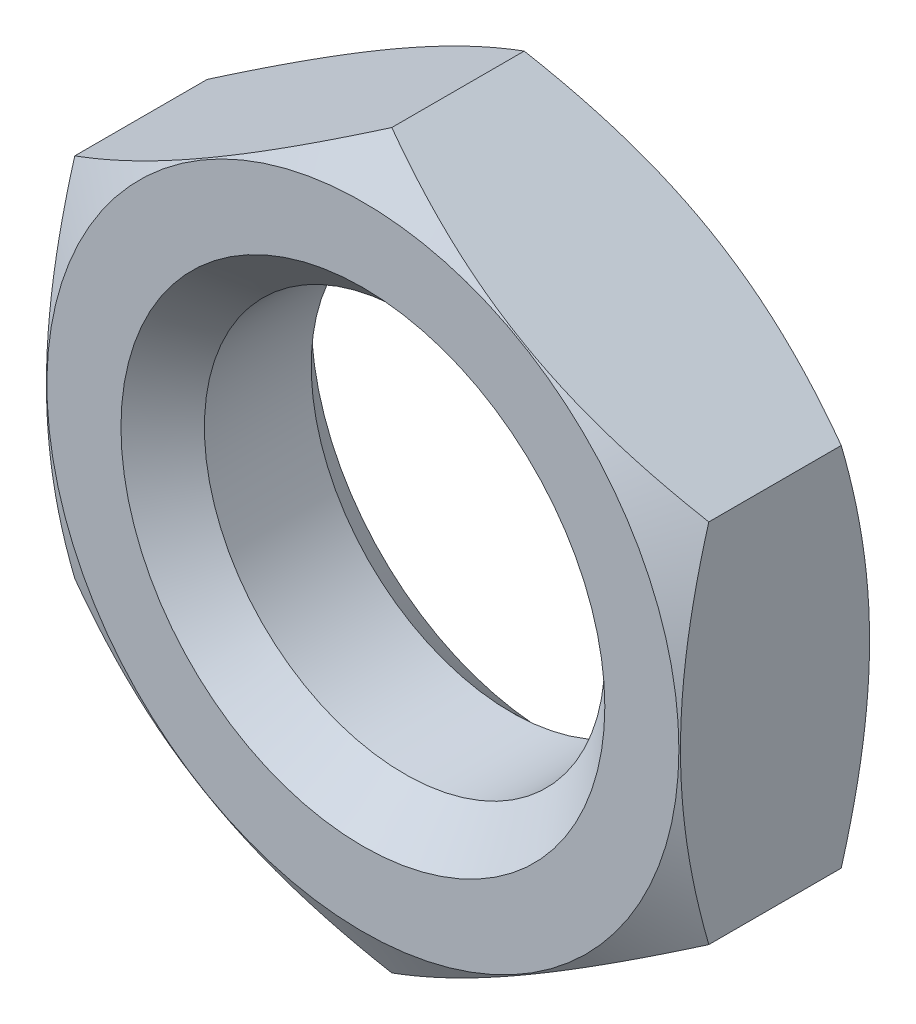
SolidWorks part; units mm, degrees
ref_plane "Front Plane" through (0, 0, 0) normal (0, 0, 1) x (1, 0, 0)
ref_plane "Top Plane" through (0, 0, 0) normal (0, 1, 0) x (1, 0, 0)
ref_plane "Right Plane" through (0, 0, 0) normal (1, 0, 0) x (0, 0, -1)
sketch "Sketch3" plane through (0, 0, 0) normal (0, 0, 1) x (1, 0, 0)
  line L1 (0, 10.9697) -> (-9.5, 5.4848)
  line L2 (-9.5, 5.4848) -> (-9.5, -5.4848)
  line L3 (-9.5, -5.4848) -> (0, -10.9697)
  line L4 (0, -10.9697) -> (9.5, -5.4848)
  line L5 (9.5, -5.4848) -> (9.5, 5.4848)
  line L6 (9.5, 5.4848) -> (0, 10.9697)
  circle A0 centre (0, 0) radius 9.5 construction
  dimension "D1" = 19
extrude "Boss-Extrude1" add sketch "Sketch3" along normal mid plane 5.7
sketch "Sketch4" plane through (0, 0, 0) normal (1, 0, 0) x (0, 0, -1)
  line L0 (-5.4578, 0) -> (6.1545, 0) construction
sketch "Sketch5" plane through (0, 0, 0) normal (1, 0, 0) x (0, 0, -1)
  line L0 (-2.85, 10.9697) -> (-2.85, 9.4697)
  line L1 (-2.85, 5.4848) -> (-2.85, 10.9697) construction
  line L2 (-2.85, 9.4697) -> (-1.984, 10.9697)
  line L3 (-2.85, 10.9697) -> (2.85, 10.9697) construction
  line L4 (-1.984, 10.9697) -> (-2.85, 10.9697)
  dimension "D1" = 1.5
  dimension "D2" = 30
revolve "Cut-Revolve1" cut sketch "Sketch5" angle 360 about L0
mirror "Mirror1" about plane through (0, 0, 0) normal (0, 0, 1) of "Cut-Revolve1"
sketch "Sketch6" plane through (0, 0, 2.85) normal (0, 0, 1) x (1, 0, 0)
  circle A0 centre (0, 0) radius 6
  dimension "D1" = 12
extrude "Cut-Extrude1" cut sketch "Sketch6" against normal blind 5.7
chamfer "Chamfer1" distance 1.25 angle 45 2 edges at (6, 0, -2.85) (6, 0, 2.85)
